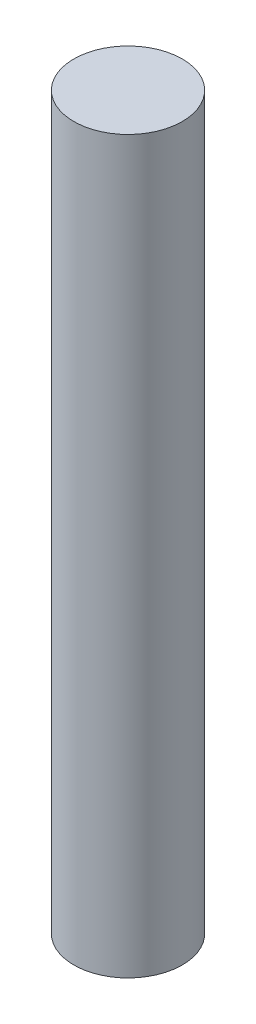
SolidWorks part; units mm, degrees
ref_plane "Front Plane" through (0, 0, 0) normal (0, 0, 1) x (1, 0, 0)
ref_plane "Top Plane" through (0, 0, 0) normal (0, 1, 0) x (1, 0, 0)
ref_plane "Right Plane" through (0, 0, 0) normal (1, 0, 0) x (0, 0, -1)
sketch "Sketch1" plane through (0, 0, 0) normal (0, 1, 0) x (1, 0, 0)
  circle A0 centre (0, 0) radius 1.97
  dimension "D1" = 3.94
extrude "Boss-Extrude1" add sketch "Sketch1" along normal blind 26.54
